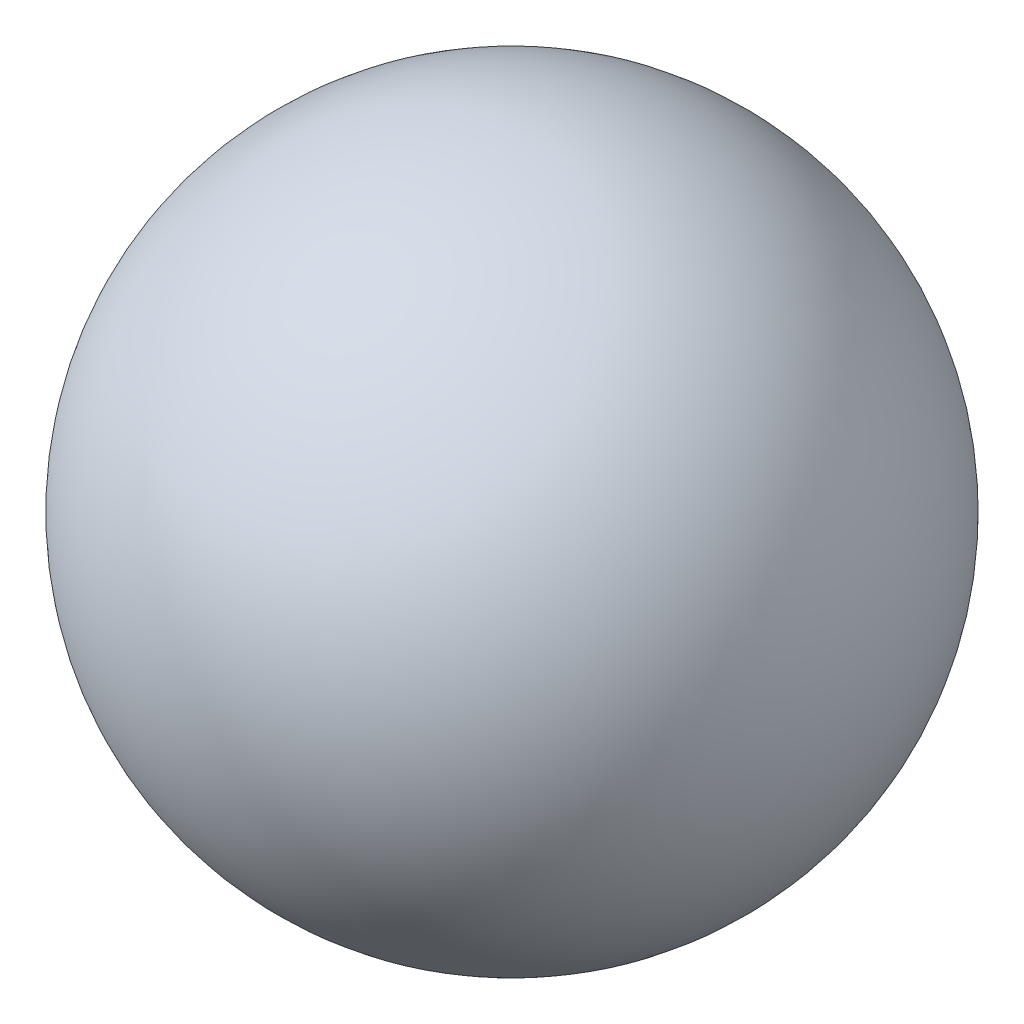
SolidWorks part; units mm, degrees
ref_plane "Front Plane" through (0, 0, 0) normal (0, 0, 1) x (1, 0, 0)
ref_plane "Top Plane" through (0, 0, 0) normal (0, 1, 0) x (1, 0, 0)
ref_plane "Right Plane" through (0, 0, 0) normal (1, 0, 0) x (0, 0, -1)
sketch "Sketch2" plane through (0, 0, 0) normal (1, 0, 0) x (0, 0, -1)
  line L0 (0, 38.1) -> (0, -38.1)
  line L1 (0, 52.591) -> (0, -48.7585) construction
  arc A0 (0, -38.1) -> (0, 38.1) centre (0, 0) ccw
  dimension "D1" = 76.2
revolve "Revolve1" add sketch "Sketch2" angle 360 about L1
